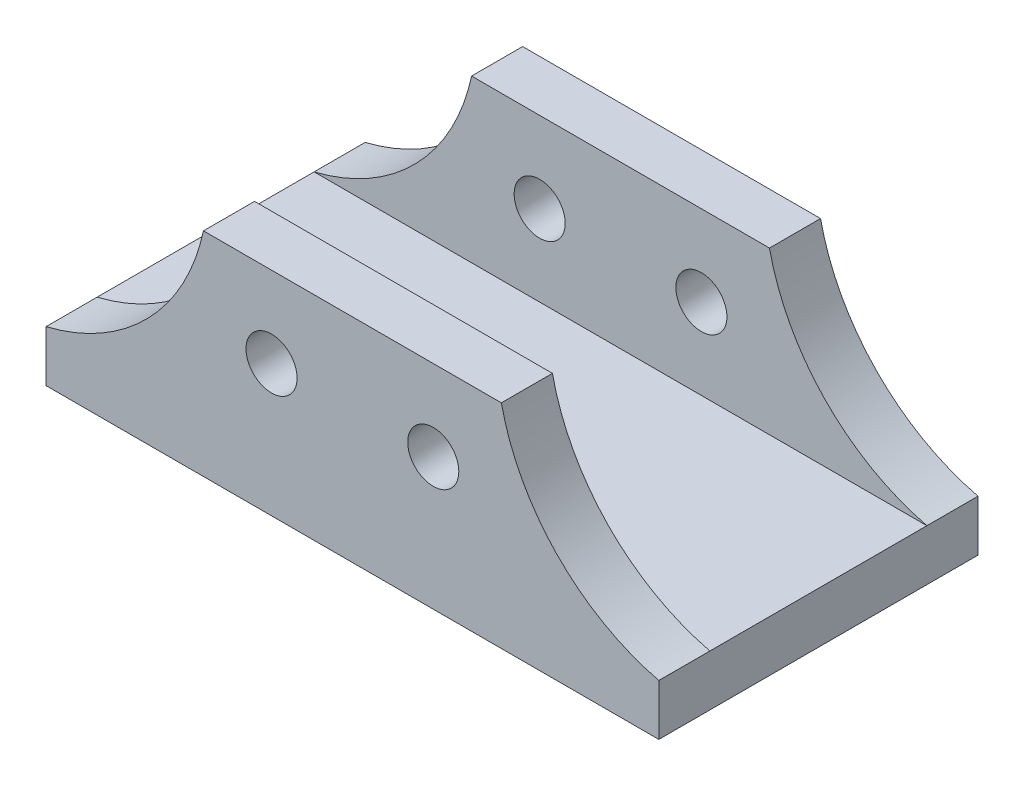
SolidWorks part; units mm, degrees
ref_plane "Front Plane" through (0, 0, 0) normal (0, 0, 1) x (1, 0, 0)
ref_plane "Top Plane" through (0, 0, 0) normal (0, 1, 0) x (1, 0, 0)
ref_plane "Right Plane" through (0, 0, 0) normal (1, 0, 0) x (0, 0, -1)
sketch "Sketch1" plane through (0, 0, 0) normal (0, 0, 1) x (1, 0, 0)
  line L0 (0, 0) -> (0, 50) construction
  line L1 (-72, 0) -> (72, 0)
  line L2 (72, 0) -> (72, 12)
  line L3 (-35, 50) -> (35, 50)
  line L4 (-72, 0) -> (-72, 12)
  arc A0 (72, 12) -> (35, 50) centre (83.8698, 60.5706) cw
  circle A1 centre (19, 31) radius 6
  circle A2 centre (-19, 31) radius 6
  arc A3 (-72, 12) -> (-35, 50) centre (-83.8698, 60.5706) ccw
  dimension "D5" = 50
  dimension "D6" = 12
  dimension "D7" = 31
  dimension "D8" = 19
  dimension "D1" = 72
  dimension "D2" = 12
  dimension "D3" = 35
  dimension "D4" = 50
extrude "Boss-Extrude1" add sketch "Sketch1" along normal blind 12
ref_plane "Plane1" through (0, 0, 37.5) normal (0, 0, 1) x (1, 0, 0)
mirror "Mirror1" about plane through (0, 0, 37.5) normal (0, 0, 1)
sketch "Sketch2" plane through (0, 0, 37.5) normal (0, 0, 1) x (1, 0, 0)
  line L1 (-72, 0) -> (72, 0)
  line L2 (-72, 0) -> (-72, 12)
  line L3 (-72, 12) -> (72, 12)
  line L4 (72, 0) -> (72, 12)
extrude "Boss-Extrude2" add sketch "Sketch2" against normal up to surface and the other way up to surface
